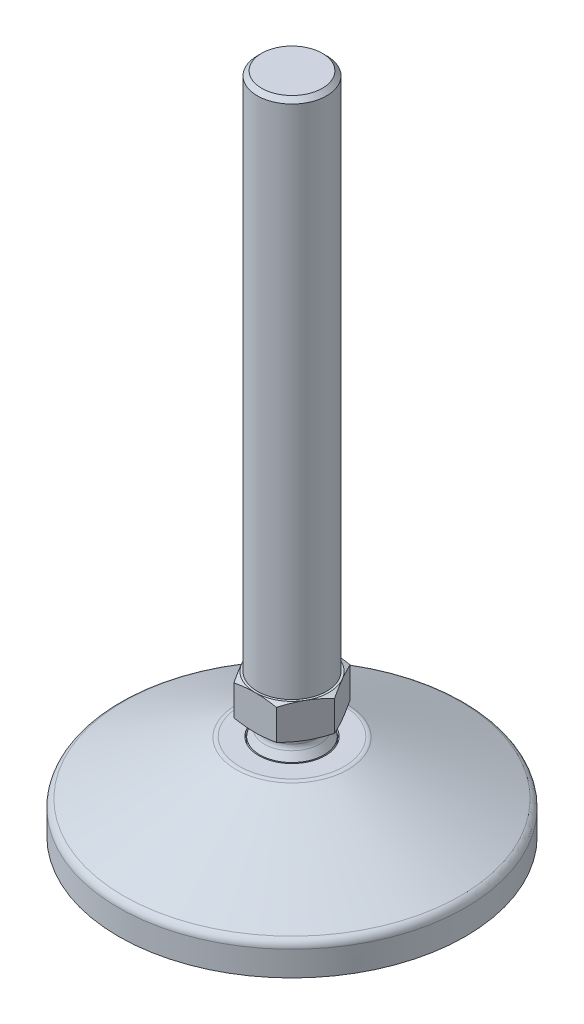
SolidWorks part; units mm, degrees
ref_plane "Front Plane" through (0, 0, 0) normal (0, 0, 1) x (1, 0, 0)
ref_plane "Top Plane" through (0, 0, 0) normal (0, 1, 0) x (1, 0, 0)
ref_plane "Right Plane" through (0, 0, 0) normal (1, 0, 0) x (0, 0, -1)
sketch "Sketch1" plane through (0, 0, 0) normal (0, 1, 0) x (1, 0, 0)
  circle A1 centre (0, 0) radius 35
  dimension "D1" = 70
extrude "Boss-Extrude1" add sketch "Sketch1" along normal blind 2
sketch "Sketch2" plane through (0, 2, 0) normal (0, 1, 0) x (1, 0, 0)
  circle A0 centre (0, 0) radius 40
  dimension "D1" = 80
extrude "Boss-Extrude2" add sketch "Sketch2" along normal blind 7
ref_plane "Plane1" through (0, 22, 0) normal (0, 1, 0) x (1, 0, 0)
sketch "Sketch3" plane through (0, 22, 0) normal (0, 1, 0) x (1, 0, 0)
  circle A0 centre (0, 0) radius 12.5
  dimension "D1" = 25
loft "Loft1" add profiles "Sketch3"
ref_plane "Plane2" through (0, 24.1, 0) normal (0, 1, 0) x (1, 0, 0)
sketch "Sketch4" plane through (0, 22, 0) normal (0, 1, 0) x (1, 0, 0)
  circle A0 centre (0, 0) radius 7.4
  dimension "D1" = 14.8
sketch "Sketch5" plane through (0, 24.1, 0) normal (0, 1, 0) x (1, 0, 0)
  circle A0 centre (0, 0) radius 6
  dimension "D1" = 12
loft "Loft2" add profiles "Sketch4", "Sketch5"
sketch "Sketch11" plane through (0, 22, 0) normal (0, 1, 0) x (1, 0, 0)
  circle A0 centre (0, 0) radius 7.4 construction
  circle A1 centre (0, 0) radius 7.4
  circle A2 centre (0, 0) radius 7.7
  dimension "D1" = 0.3
extrude "Cut-Extrude1" cut sketch "Sketch11" against normal blind 1
sketch "Sketch6" plane through (0, 24.1, 0) normal (0, 1, 0) x (1, 0, 0)
  circle A1 centre (0, 0) radius 6
  circle A2 centre (0, 0) radius 6
  dimension "D1" = 0
extrude "Boss-Extrude3" add sketch "Sketch6" along normal blind 2.9
sketch "Sketch7" plane through (0, 27, 0) normal (0, 1, 0) x (1, 0, 0)
  circle A0 centre (0, 0) radius 8
  dimension "D1" = 16
extrude "Boss-Extrude4" add sketch "Sketch7" along normal blind 128
ref_plane "Plane3" through (0, 27, 0) normal (0, 1, 0) x (1, 0, 0)
sketch "Sketch8" plane through (0, 27, 0) normal (0, 1, 0) x (1, 0, 0)
  line L1 (9.815, 0) -> (4.9075, 8.5)
  line L2 (4.9075, 8.5) -> (-4.9075, 8.5)
  line L3 (-4.9075, 8.5) -> (-9.815, 0)
  line L4 (-9.815, 0) -> (-4.9075, -8.5)
  line L5 (-4.9075, -8.5) -> (4.9075, -8.5)
  line L6 (4.9075, -8.5) -> (9.815, 0)
  circle A0 centre (0, 0) radius 8.5 construction
  circle A1 centre (0, 0) radius 8 construction
  circle A2 centre (0, 0) radius 8
  dimension "D1" = 17
extrude "Boss-Extrude5" add sketch "Sketch8" along normal blind 8
sketch "Sketch9" plane through (0, 0, 0) normal (0, 0, 1) x (1, 0, 0)
  line L0 (-8.5, 35) -> (-9.815, 34.5)
  line L1 (-9.815, 35) -> (-4.9075, 35) construction
  line L2 (-9.815, 35) -> (-9.815, 27) construction
  line L3 (-9.815, 27.5) -> (-8.5, 27)
  line L4 (-9.815, 27) -> (-4.9075, 27) construction
  line L5 (-8.5, 35) -> (-8.5, 27) construction
  line L6 (0, -44) -> (0, 44) construction
  line L7 (-9.815, 27.5) -> (-9.815, 27)
  line L8 (-9.815, 27) -> (-8.5, 27)
  line L9 (-8.5, 35) -> (-9.815, 35)
  line L10 (-9.815, 35) -> (-9.815, 34.5)
  dimension "D1" = 8.5
  dimension "D2" = 0.5
  dimension "D3" = 0.5
revolve "Cut-Revolve1" cut sketch "Sketch9" angle 360 about axis through (0, 155, 0) along (0, -1, 0)
chamfer "Chamfer1" distance 1 angle 45 1 edges at (0, 155, 8)
sketch "Sketch10" plane through (0, 0, 0) normal (0, -1, 0) x (1, 0, 0)
  line L0 (3, 6) -> (30.9233, 6)
  line L2 (-3, -31.3568) -> (-3, -6)
  line L4 (3, -31.3568) -> (3, -6)
  line L5 (-3, -31.3568) -> (3, 31.3568) construction
  line L6 (-3, 31.3568) -> (3, -31.3568) construction
  line L7 (-30.9233, -6) -> (-3, -6)
  line L9 (-30.9233, 6) -> (-3, 6)
  line L11 (-30.9233, -6) -> (30.9233, 6) construction
  line L12 (-30.9233, 6) -> (30.9233, -6) construction
  line L13 (3, 6) -> (3, 31.3568)
  line L14 (-3, 6) -> (-3, 31.3568)
  line L15 (3, -6) -> (30.9233, -6)
  arc A0 (-30.9233, -6) -> (-3, -31.3568) centre (0, 0) ccw
  arc A1 (30.9233, 6) -> (3, 31.3568) centre (0, 0) ccw
  arc A2 (-3, 31.3568) -> (-30.9233, 6) centre (0, 0) ccw
  arc A3 (3, -31.3568) -> (30.9233, -6) centre (0, 0) ccw
  dimension "D1" = 63
  dimension "D2" = 6
  dimension "D3" = 12
extrude "Boss-Extrude6" add sketch "Sketch10" along normal blind 1
fillet "Fillet1" radius 2 2 edges at (0, 9, 40) (0, 22, 12.5)
fillet "Fillet2" radius 2 1 edges at (0, 24.1, 6)
fillet "Fillet3" radius 1 12 edges at (3, -0.5, -31.3568) (3, -0.5, -6) (30.9233, -0.5, -6) (30.9233, -0.5, 6) (3, -0.5, 31.3568) (3, -0.5, 6) (-3, -0.5, 31.3568) (-3, -0.5, 6) (-30.9233, -0.5, 6) (-30.9233, -0.5, -6) (-3, -0.5, -31.3568) (-3, -0.5, -6)
